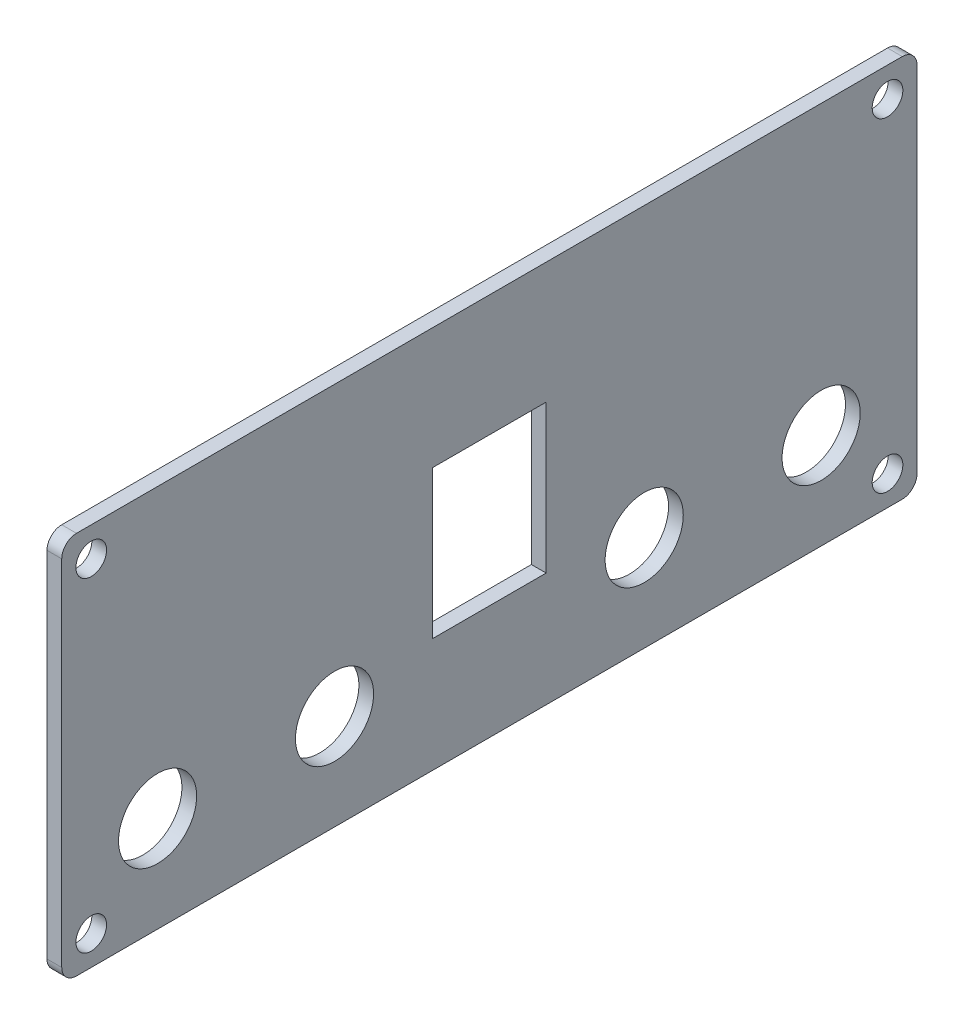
SolidWorks part; units mm, degrees
other "<Endplate-43>-<Fillet1>"
ref_plane "Front Plane" through (0, 0, 0) normal (0, 0, 1) x (1, 0, 0)
ref_plane "Top Plane" through (0, 0, 0) normal (0, 1, 0) x (1, 0, 0)
ref_plane "Right Plane" through (0, 0, 0) normal (1, 0, 0) x (0, 0, -1)
inserted part "Endplate-43"
sketch "Sketch1" plane through (-32.1807, 0, 0) normal (1, 0, 0) x (0, 0, -1)
  line L1 (1.5447, -61.3781) -> (66.5158, -61.3781)
  line L2 (1.5447, -61.3781) -> (1.5447, -69.6481)
  line L3 (1.5447, -69.6481) -> (66.5158, -69.6481)
  line L4 (66.5158, -61.3781) -> (66.5158, -69.6481)
extrude "Boss-Extrude1" add sketch "Sketch1" against normal up to surface (1.27 mm away)
ref_plane "Plane1" through (0, 0, -34.3798) normal (0, 0, 1) x (1, 0, 0)
sketch "Sketch2" plane through (-32.1807, 0, 0) normal (1, 0, 0) x (0, 0, -1)
  line L0 (34.3798, 0.6985) -> (34.3798, -0.6985) construction
  line L1 (29.4903, -51.6356) -> (39.2693, -51.6356)
  line L2 (29.4903, -51.6356) -> (29.4903, -64.3864)
  line L3 (29.4903, -64.3864) -> (39.2693, -64.3864)
  line L4 (39.2693, -51.6356) -> (39.2693, -64.3864)
  line L5 (29.4903, -51.6356) -> (39.2693, -64.3864) construction
  line L6 (29.4903, -64.3864) -> (39.2693, -51.6356) construction
  circle A0 centre (62.9548, -65.9612) radius 3.3655
  circle A1 centre (68.6698, -71.6762) radius 1.3208 construction
  circle A2 centre (47.7148, -65.9612) radius 3.3655
  point P4 (34.3798, -58.011)
  dimension "D1" = 6.731
  dimension "D3" = 5.715
  dimension "D2" = 5.715
  dimension "D5" = 20.955
  dimension "D6" = 9.779
  dimension "D7" = 12.7508
  dimension "D8" = 20.0406
  dimension "D4" = 2
extrude "Cut-Extrude1" cut sketch "Sketch2" against normal through all
mirror "Mirror1" about plane through (0, 0, -34.3798) normal (0, 0, 1) of "Cut-Extrude1"
